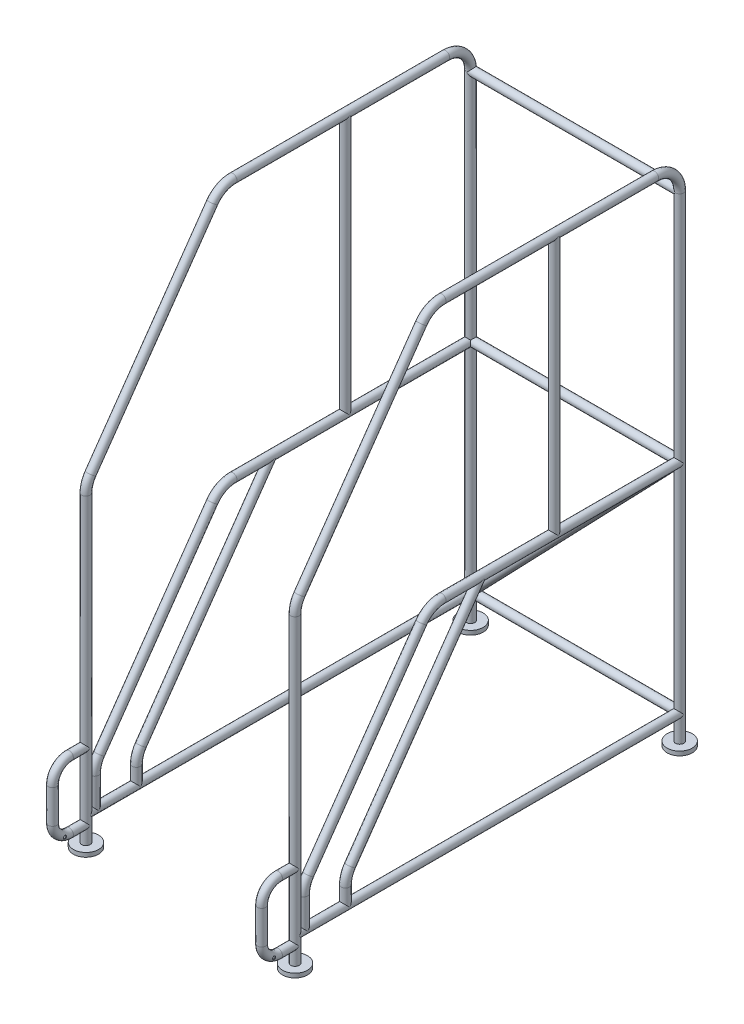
SolidWorks part; units mm, degrees
ref_plane "Default Plane" through (-279.4, 12.7, 0) normal (0, -1, 0) x (-1, 0, 0)
sketch3d "Bounding-Box_Cut-List-Item7"
  line L0 (-2.0852, -35.8939, 0) -> (73.9939, -40.1852, 0) construction
  line L1 (73.9939, -40.1852, 0) -> (78.2852, 35.8939, 0) construction
  line L2 (78.2852, 35.8939, 0) -> (2.2061, 40.1852, 0) construction
  line L3 (2.2061, 40.1852, 0) -> (-2.0852, -35.8939, 0) construction
  line L4 (-2.0852, -35.8939, 12.7) -> (73.9939, -40.1852, 12.7) construction
  line L5 (73.9939, -40.1852, 12.7) -> (78.2852, 35.8939, 12.7) construction
  line L6 (78.2852, 35.8939, 12.7) -> (2.2061, 40.1852, 12.7) construction
  line L7 (2.2061, 40.1852, 12.7) -> (-2.0852, -35.8939, 12.7) construction
  line L8 (-2.0852, -35.8939, 0) -> (-2.0852, -35.8939, 12.7) construction
  line L9 (73.9939, -40.1852, 0) -> (73.9939, -40.1852, 12.7) construction
  line L10 (78.2852, 35.8939, 0) -> (78.2852, 35.8939, 12.7) construction
  line L11 (2.2061, 40.1852, 0) -> (2.2061, 40.1852, 12.7) construction
ref_plane "Front Plane" through (0, 0, 0) normal (0, 0, 1) x (1, 0, 0)
ref_plane "Top Plane" through (0, 0, 0) normal (0, 1, 0) x (1, 0, 0)
ref_plane "Right Plane" through (0, 0, 0) normal (1, 0, 0) x (0, 0, -1)
ref_plane "Plane1" through (317.5, 0, 0) normal (1, 0, 0) x (0, 0, -1)
sketch "Frame Sketch" plane through (317.5, 0, 0) normal (1, 0, 0) x (0, 0, -1)
  line L0 (0, 12.7) -> (0, 932.1086)
  line L1 (13.7745, 975.8065) -> (383.6485, 1504.1978)
  line L2 (446.074, 1536.7) -> (1092.2, 1536.7)
  line L3 (1168.4, 1460.5) -> (1168.4, 12.7)
  line L4 (0, 88.9) -> (1168.4, 88.9)
  line L5 (26.1874, 88.9) -> (26.1874, 182.1192)
  line L6 (39.9619, 225.817) -> (383.6485, 716.7978)
  line L7 (446.074, 749.3) -> (1168.4, 749.3)
  line L8 (787.4, 1536.7) -> (787.4, 749.3)
  line L9 (0, 1282.7) -> (0, 1536.7) construction
  line L10 (0, 1536.7) -> (177.8, 1536.7) construction
  line L11 (177.8, 1536.7) -> (0, 1282.7) construction
  line L12 (153.1874, 88.9) -> (153.1874, 142.086)
  line L13 (166.9619, 185.7838) -> (561.4233, 749.3)
  line L14 (153.1874, 166.1059) -> (510.4425, 676.4703) construction
  line L15 (26.1874, 206.1391) -> (406.4, 749.3) construction
  line L16 (26.1874, 88.9) -> (26.1874, 206.1391) construction
  line L17 (153.1874, 88.9) -> (153.1874, 166.1059) construction
  line L18 (0, 63.5) -> (-50.8, 63.5)
  line L19 (-101.6, 114.3) -> (-101.6, 215.9)
  line L20 (-50.8, 266.7) -> (0, 266.7)
  arc A0 (383.6485, 716.7978) -> (446.074, 749.3) centre (446.074, 673.1) cw
  arc A1 (26.1874, 182.1192) -> (39.9619, 225.817) centre (102.3874, 182.1192) cw
  arc A2 (153.1874, 142.086) -> (166.9619, 185.7838) centre (229.3874, 142.086) cw
  arc A3 (1092.2, 1536.7) -> (1168.4, 1460.5) centre (1092.2, 1460.5) cw
  arc A4 (383.6485, 1504.1978) -> (446.074, 1536.7) centre (446.074, 1460.5) cw
  arc A5 (0, 932.1086) -> (13.7745, 975.8065) centre (76.2, 932.1086) cw
  arc A6 (-50.8, 63.5) -> (-101.6, 114.3) centre (-50.8, 114.3) cw
  arc A7 (-101.6, 215.9) -> (-50.8, 266.7) centre (-50.8, 215.9) cw
  point P26 (406.4, 749.3)
  point P35 (1168.4, 1536.7)
  point P38 (406.4, 1536.7)
  point P41 (0, 956.1286)
  point P47 (-101.6, 63.5)
  point P50 (-101.6, 266.7)
  dimension "D13" = 76.2
  dimension "D17" = 50.8
  dimension "D1" = 1524
  dimension "D2" = 1168.4
  dimension "D3" = 12.7
  dimension "D4" = 76.2
  dimension "D5" = 736.6
  dimension "D6" = 762
  dimension "D7" = 26.1874
  dimension "D8" = 381
  dimension "D9" = 762
  dimension "D10" = 254
  dimension "D11" = 177.8
  dimension "D14" = 101.6
  dimension "D15" = 203.2
  dimension "D16" = 50.8
  dimension "D12" = 127
other "Al round tubing 1 OD X 0.095 WALL(1)"
ref_plane "Plane2" through (317.5, 12.7, 0) normal (0, 1, 0) x (0, 0, 1)
sketch "Sketch1" plane through (317.5, 12.7, 0) normal (0, 1, 0) x (0, 0, 1)
  circle A0 centre (0, 0) radius 10.287
  circle A1 centre (0, 0) radius 12.7
  point P3 (0, 0)
  dimension "In_dia" = 20.574
  dimension "Out_dia" = 25.4
sketch "Sketch2" plane through (317.5, 0, 0) normal (1, 0, 0) x (0, 0, -1)
  line L0 (0, 12.7) -> (0, 932.1086) construction
  circle A0 centre (-76.2, 70.3059) radius 4.7625
  arc A1 (-101.6, 114.3) -> (-50.8, 63.5) centre (-50.8, 114.3) ccw construction
  dimension "D1" = 9.525
  dimension "D2" = 76.2
extrude "Cut-Extrude1" cut sketch "Sketch2" against normal through all both and the other way through all
sketch "Sketch3" plane through (0, 12.7, 0) normal (0, -1, 0) x (1, 0, 0)
  circle A0 centre (317.5, 0) radius 38.1
  circle A1 centre (317.5, -1168.4) radius 38.1
  dimension "D1" = 76.2
extrude "Boss-Extrude1" add sketch "Sketch3" along normal blind 12.7 separate body
mirror "Mirror1" about plane through (0, 0, 0) normal (1, 0, 0)
ref_plane "Plane3" through (0, 0, -1168.4) normal (0, 0, 1) x (1, 0, 0)
sketch "Connecting Members" plane through (0, 0, -1168.4) normal (0, 0, 1) x (1, 0, 0)
  line L0 (0, 0) -> (0, 1460.5) construction
  line L1 (-317.5, 88.9) -> (317.5, 88.9)
  line L2 (-317.5, 749.3) -> (317.5, 749.3)
  line L3 (-317.5, 1460.5) -> (317.5, 1460.5)
  line L4 (317.5, 1460.5) -> (317.5, 12.7) construction
  line L5 (-317.5, 88.9) -> (317.5, 749.3)
  point P15 (0, 749.3)
  point P16 (0, 88.9)
other "Al round tubing 1 OD X 0.095 WALL(2)"
ref_plane "Plane4" through (-317.5, 88.9, -1168.4) normal (1, 0, 0) x (0, 1, 0)
sketch "Sketch11" plane through (-317.5, 88.9, -1168.4) normal (1, 0, 0) x (0, 1, 0)
  circle A0 centre (0, 0) radius 10.287
  circle A1 centre (0, 0) radius 12.7
  point P3 (0, 0)
  dimension "In_dia" = 20.574
  dimension "Out_dia" = 25.4
other "Trim/Extend1"
other "Trim/Extend2"
